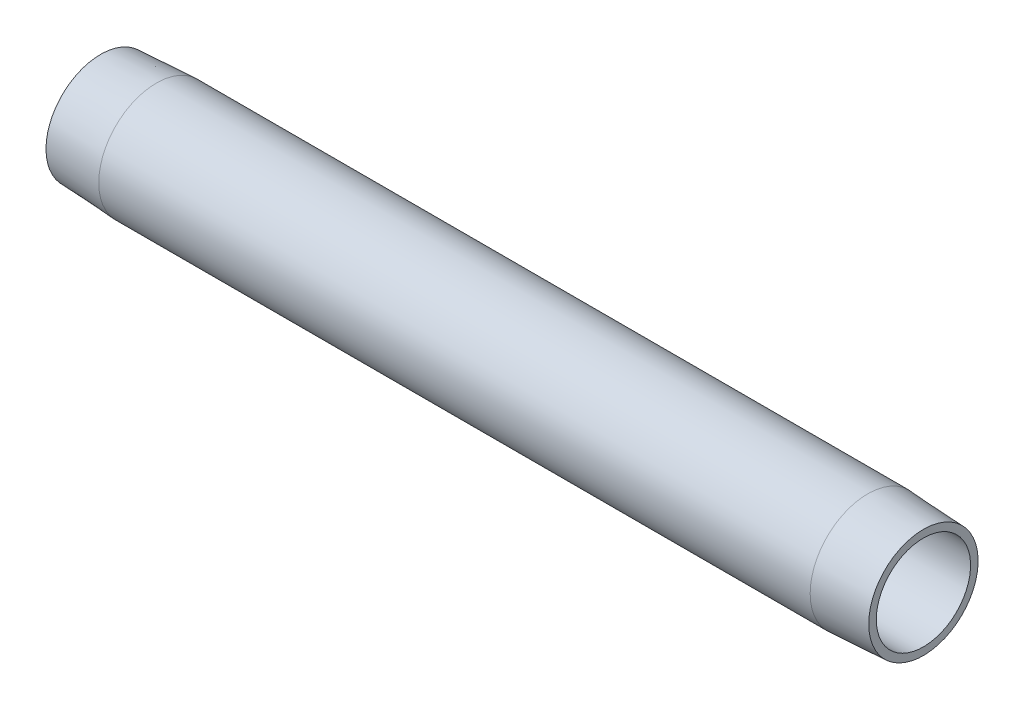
SolidWorks part; units mm, degrees
ref_plane "Front Plane" through (0, 0, 0) normal (0, 0, 1) x (1, 0, 0)
ref_plane "Top Plane" through (0, 0, 0) normal (0, 1, 0) x (1, 0, 0)
ref_plane "Right Plane" through (0, 0, 0) normal (1, 0, 0) x (0, 0, -1)
sketch "Sketch1" plane through (0, 0, 0) normal (0, 0, 1) x (1, 0, 0)
  line L6 (152.4, 8.7313) -> (0, 8.7313)
  line L7 (10.3124, 10.668) -> (0, 10.1276)
  line L8 (142.0876, 10.668) -> (10.3124, 10.668)
  line L9 (152.4, 10.1276) -> (142.0876, 10.668)
  line L10 (152.4, 8.7313) -> (152.4, 10.1276)
  line L11 (0, 10.1276) -> (0, 8.7313)
  line L12 (0, 0) -> (50000, 0) construction
  line L13 (0, -55) -> (0, 55) construction
  dimension "D1" = 152.4
  dimension "D2" = 3
  dimension "D3" = 3
  dimension "D4" = 21.336
  dimension "D5" = 17.4625
  dimension "D6" = 10.3124
  dimension "D7" = 10.3124
revolve "Revolve1" add sketch "Sketch1" angle 360 about L12
